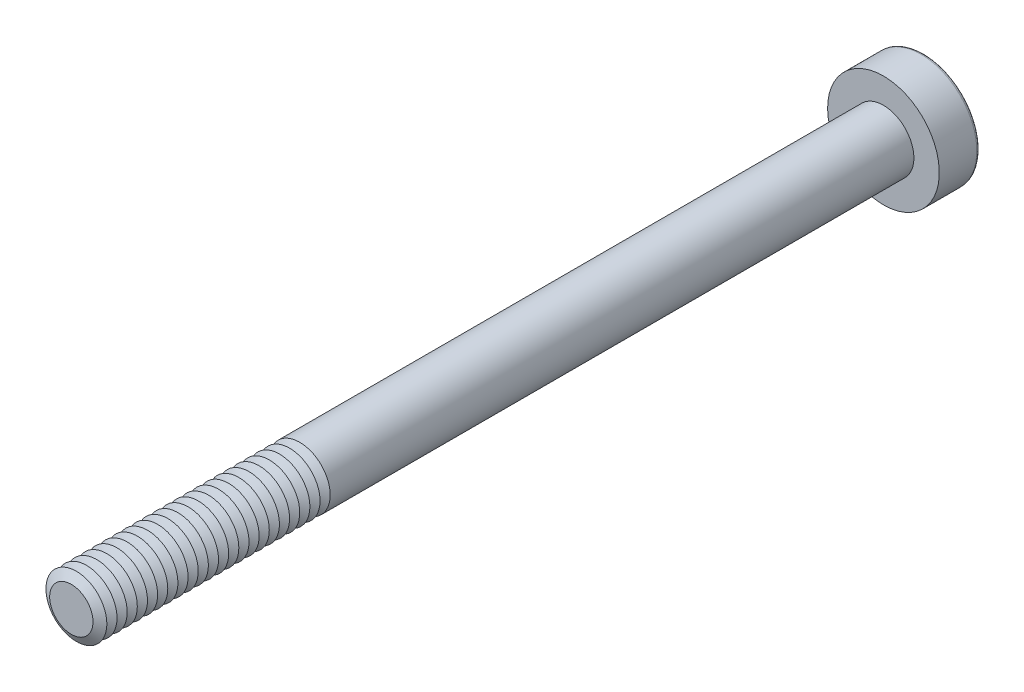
SolidWorks part; units mm, degrees
ref_plane "Front Plane" through (0, 0, 0) normal (0, 0, 1) x (1, 0, 0)
ref_plane "Top Plane" through (0, 0, 0) normal (0, 1, 0) x (1, 0, 0)
ref_plane "Right Plane" through (0, 0, 0) normal (1, 0, 0) x (0, 0, -1)
sketch "Sketch1" plane through (0, 0, 0) normal (0, 0, 1) x (1, 0, 0)
  circle A0 centre (0, 0) radius 1.5
  dimension "D1" = 3
extrude "Boss-Extrude1" add sketch "Sketch1" along normal blind 40
sketch "Sketch2" plane through (0, 0, 0) normal (0, 0, -1) x (-1, 0, 0)
  circle A0 centre (0, 0) radius 2.75
  dimension "D1" = 5.5
extrude "Boss-Extrude2" add sketch "Sketch2" along normal blind 2
sketch "Sketch3" plane through (0, 0, -2) normal (0, 0, -1) x (-1, 0, 0)
  line L1 (-0.5774, 1) -> (-1.1547, 0)
  line L2 (-1.1547, 0) -> (-0.5774, -1)
  line L3 (-0.5774, -1) -> (0.5774, -1)
  line L4 (0.5774, -1) -> (1.1547, 0)
  line L5 (1.1547, 0) -> (0.5774, 1)
  line L6 (0.5774, 1) -> (-0.5774, 1)
  circle A0 centre (0, 0) radius 1 construction
  dimension "D1" = 2
extrude "Cut-Extrude1" cut sketch "Sketch3" against normal blind 1.5
fillet "Fillet1" radius 0.15 1 edges at (-2.75, 0, -2)
sketch "Sketch4" plane through (0, 0, -0.5) normal (0, 0, -1) x (-1, 0, 0)
  line L0 (0.5774, -1) -> (1.1547, 0) construction
  circle A0 centre (0, 0) radius 1
extrude "Cut-Extrude2" cut sketch "Sketch4" against normal through all draft 60
sketch "Sketch5" plane through (0, 0, -2) normal (0, 0, -1) x (-1, 0, 0)
  circle A0 centre (0, 0) radius 1.1547
extrude "Cut-Extrude3" cut sketch "Sketch5" against normal through all draft 75
sketch "Sketch7" plane through (0, 0, 0) normal (1, 0, 0) x (0, 0, -1)
  line L25 (-40, 1.067) -> (-39.75, 1.5)
  line L26 (-40, 1.5) -> (-40, -1.5) construction
  line L27 (-39.75, 1.5) -> (-40.25, 1.5)
  line L28 (-40.25, 1.5) -> (-40, 1.067)
  line L29 (0, 1.5) -> (-40, 1.5) construction
  dimension "D1" = 0.5
revolve "Cut-Revolve1" cut sketch "Sketch7" angle 360 about axis through (0, 0, 40) along (0, 0, -1)
pattern_linear "LPattern1" count 23 spacing 0.5 along (0, 0, -1) of "Cut-Revolve1"
